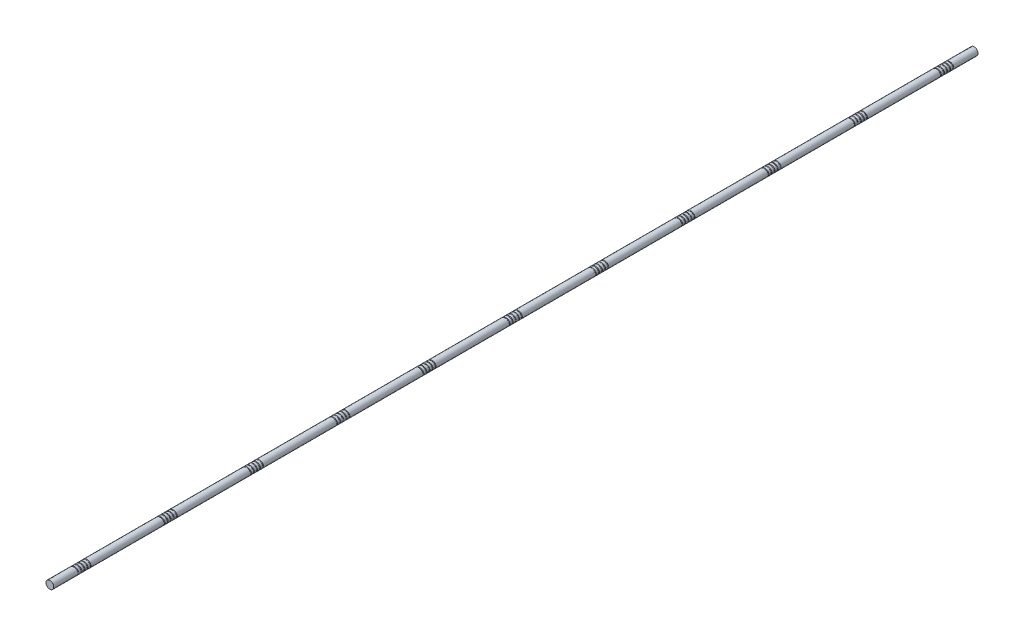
SolidWorks part; units mm, degrees
ref_plane "Front Plane" through (0, 0, 0) normal (0, 0, 1) x (1, 0, 0)
ref_plane "Top Plane" through (0, 0, 0) normal (0, 1, 0) x (1, 0, 0)
ref_plane "Right Plane" through (0, 0, 0) normal (1, 0, 0) x (0, 0, -1)
sketch "Sketch1" plane through (0, 0, 0) normal (0, 0, 1) x (1, 0, 0)
  circle A0 centre (0, 0) radius 25
  dimension "D1" = 50
extrude "Boss-Extrude1" add sketch "Sketch1" along normal blind 6000
ref_plane "Plane1" through (0, 0, 150) normal (0, 0, 1) x (1, 0, 0)
sketch "Sketch2" plane through (0, 0, 150) normal (0, 0, 1) x (1, 0, 0)
  circle A0 centre (0, 0) radius 27.1167
  dimension "D1" = 54.2333
curve "Helix/Spiral1"
sketch "Sketch3" plane through (0, 0, 0) normal (0, 1, 0) x (1, 0, 0)
  circle A0 centre (-27.1167, -150) radius 3.175
  spline S0 degree 3 number of poles 118 (-27.1167, -150) -> (-27.1167, -250) construction
  dimension "D1" = 6.35
sweep "Cut-Sweep1" cut profiles "Sketch3" path "Helix/Spiral1"
pattern_linear "LPattern1" count 11 spacing 560 along (0, 0, -1) of "Cut-Sweep1"
